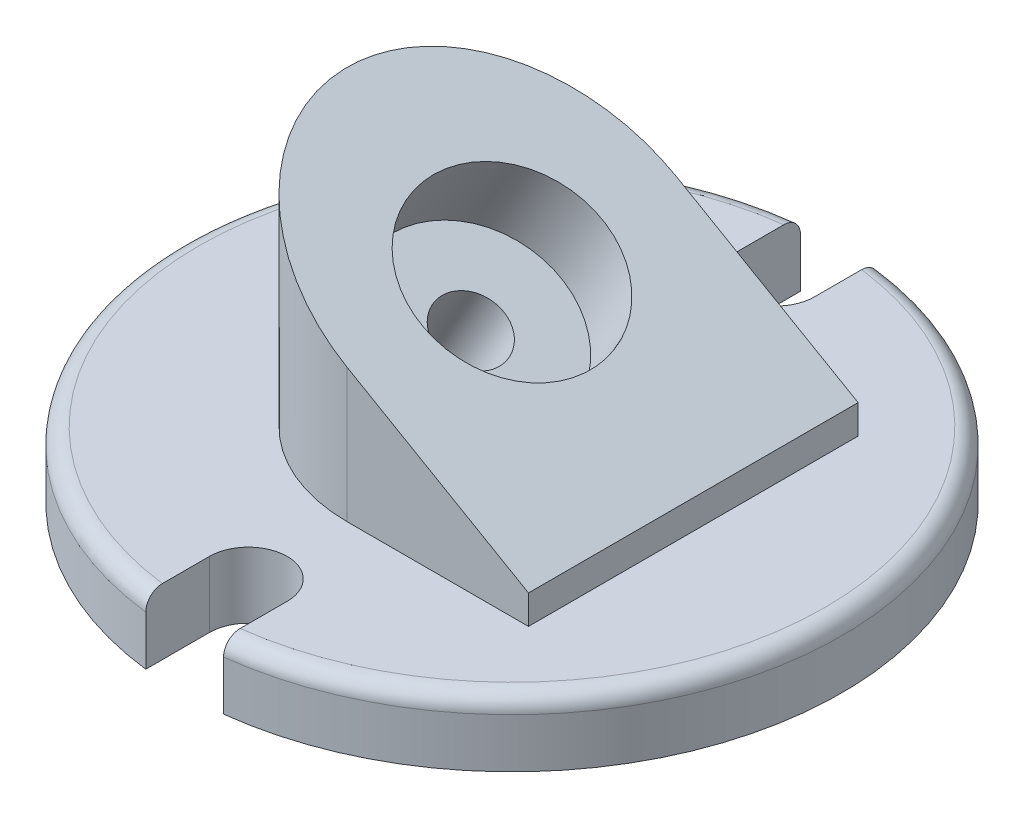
SolidWorks part; units mm, degrees
ref_plane "Front" through (0, 0, 0) normal (0, 0, 1) x (1, 0, 0)
ref_plane "Top" through (0, 0, 0) normal (0, 1, 0) x (1, 0, 0)
ref_plane "Right" through (0, 0, 0) normal (1, 0, 0) x (0, 0, -1)
sketch "Sketch1" plane through (0, 0, 0) normal (0, 1, 0) x (1, 0, 0)
  line L0 (7.493, 63.0564) -> (7.493, 50.8)
  line L1 (-7.493, 63.0564) -> (-7.493, 50.8)
  line L3 (-7.493, -63.0564) -> (-7.493, -50.8)
  line L4 (7.493, -63.0564) -> (7.493, -50.8)
  arc A0 (-7.493, 63.0564) -> (-7.493, -63.0564) centre (0, 0) ccw
  arc A1 (7.493, 50.8) -> (-7.493, 50.8) centre (0, 50.8) cw
  arc A2 (7.493, -50.8) -> (-7.493, -50.8) centre (0, -50.8) ccw
  arc A3 (7.493, -63.0564) -> (7.493, 63.0564) centre (0, 0) ccw
  dimension "D1" = 127
  dimension "D3" = 50.8
  dimension "D2" = 14.986
extrude "Base-Extrude" add sketch "Sketch1" along normal blind 12.7
sketch "Sketch2" plane through (0, 0, 0) normal (0, -1, 0) x (1, 0, 0)
  line L0 (0, 0) -> (34.4303, 0) construction
  line L1 (34.925, 31.75) -> (34.925, -31.75)
  line L2 (34.925, -31.75) -> (0, -31.75)
  line L3 (34.925, 31.75) -> (0, 31.75)
  arc A0 (0, -31.75) -> (0, 31.75) centre (0, 0) cw
  point P5 (34.925, 0)
  dimension "D2" = 34.925
  dimension "D1" = 63.5
extrude "Boss-Extrude1" add sketch "Sketch2" against normal blind 18.288
ref_plane "Plane4" through (16.6502, 28.839, 0) normal (0.5, 0.866, 0) x (-0.866, 0.5, 0)
sketch "Sketch3" plane through (0, 18.288, 0) normal (0, 1, 0) x (-1, 0, 0)
  line L3 (-34.925, -31.75) -> (0, -31.75)
  line L4 (0, 31.75) -> (-34.925, 31.75)
  line L5 (-34.925, 31.75) -> (-34.925, -31.75)
  line L6 (-34.925, -31.75) -> (0, -31.75)
  line L7 (0, 31.75) -> (-34.925, 31.75)
  line L8 (-34.925, 31.75) -> (-34.925, -31.75)
  arc A1 (0, -31.75) -> (0, 31.75) centre (0, 0) ccw
  arc A2 (0, -31.75) -> (0, 31.75) centre (0, 0) ccw
  dimension "D1" = 0
extrude "Boss-Extrude2" add sketch "Sketch3" along normal up to surface (20.164 mm away)
fillet "Fillet1" radius 3.175 2 edges at (-63.5, 12.7, 0) (7.493, 6.35, 63.0564)
hole_wizard "Hole1" positions "Sketch5" profile "Sketch4" legacy
sketch "Sketch5" plane through (16.6502, 28.839, 0) normal (0.5, 0.866, 0) x (-0.866, 0.5, 0)
  ellipse E0 centre (19.226, 0) end of major axis (-17.4358, 0) minor radius 31.75 (19.226, -31.75) -> (19.226, 31.75) ccw construction
  point P0 (19.226, 0)
sketch "Sketch4" plane through (0, 38.452, 0) normal (0, 0, 1) x (-0.866, 0.5, 0)
  line L0 (0, 0) -> (0, 100)
  line L1 (0, 100) -> (6.35, 100)
  line L2 (6.35, 100) -> (6.35, 15.875)
  line L3 (6.35, 15.875) -> (17.4625, 15.875)
  line L4 (17.4625, 15.875) -> (17.4625, 0)
  line L5 (17.4625, 0) -> (0, 0)
  line L6 (0, 110) -> (0, -10) construction
  dimension "Diameter" = 12.7
  dimension "Depth" = 100
  dimension "C-Bore Diameter" = 34.925
  dimension "C-Bore Depth" = 15.875
